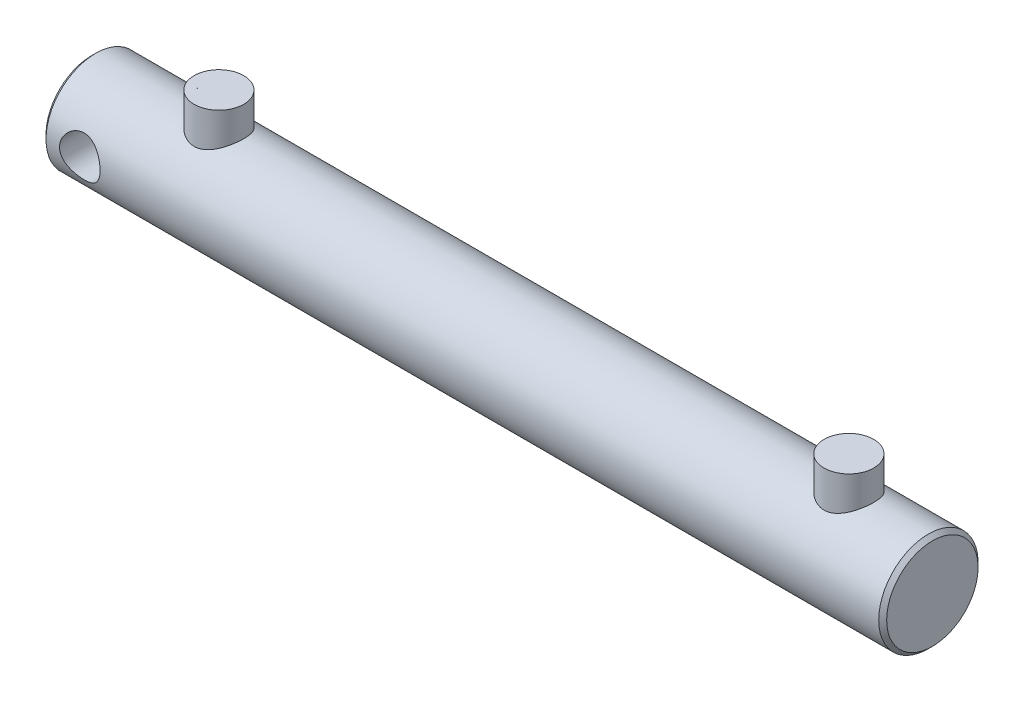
SolidWorks part; units mm, degrees
ref_plane "Plan de face" through (0, 0, 0) normal (0, 0, 1) x (1, 0, 0)
ref_plane "Plan de dessus" through (0, 0, 0) normal (0, 1, 0) x (1, 0, 0)
ref_plane "Plan de droite" through (0, 0, 0) normal (1, 0, 0) x (0, 0, -1)
sketch "Esquisse1" plane through (0, 0, 0) normal (0, 0, 1) x (1, 0, 0)
  line L0 (-211.5, 0) -> (211.5, 0) construction
  line L1 (-211.5, 0) -> (-211.5, 25)
  line L2 (-211.5, 25) -> (211.5, 25)
  line L3 (211.5, 25) -> (211.5, 0)
  line L6 (-211.5, 0) -> (211.5, 0)
  dimension "D1" = 50
  dimension "D3" = 423
revolve "Révolution1" add sketch "Esquisse1" angle 360 about L0
chamfer "Chanfrein1" distance 2 angle 45 2 edges at (211.5, 0, 25) (-211.5, 0, 25)
sketch "Esquisse3" plane through (0, 0, 0) normal (0, 0, 1) x (1, 0, 0)
  line L0 (-211.5, 23) -> (-211.5, -23) construction
  circle A0 centre (-192.5, 0) radius 10.2
  dimension "D1" = 20.4
  dimension "D2" = 19
extrude "Enlèv. mat.-Extru.1" cut sketch "Esquisse3" against normal through all and the other way through all
sketch "Esquisse5" plane through (0, 0, 0) normal (0, 1, 0) x (1, 0, 0)
  line L0 (-211.5, 23) -> (-211.5, -23) construction
  line L1 (211.5, -23) -> (211.5, 23) construction
  circle A0 centre (-147.5, 0) radius 12.5
  circle A1 centre (169.5, 0) radius 12.5
  dimension "D1" = 25
  dimension "D2" = 64
  dimension "D3" = 42
extrude "Extrusion2" add sketch "Esquisse5" along normal blind 40
